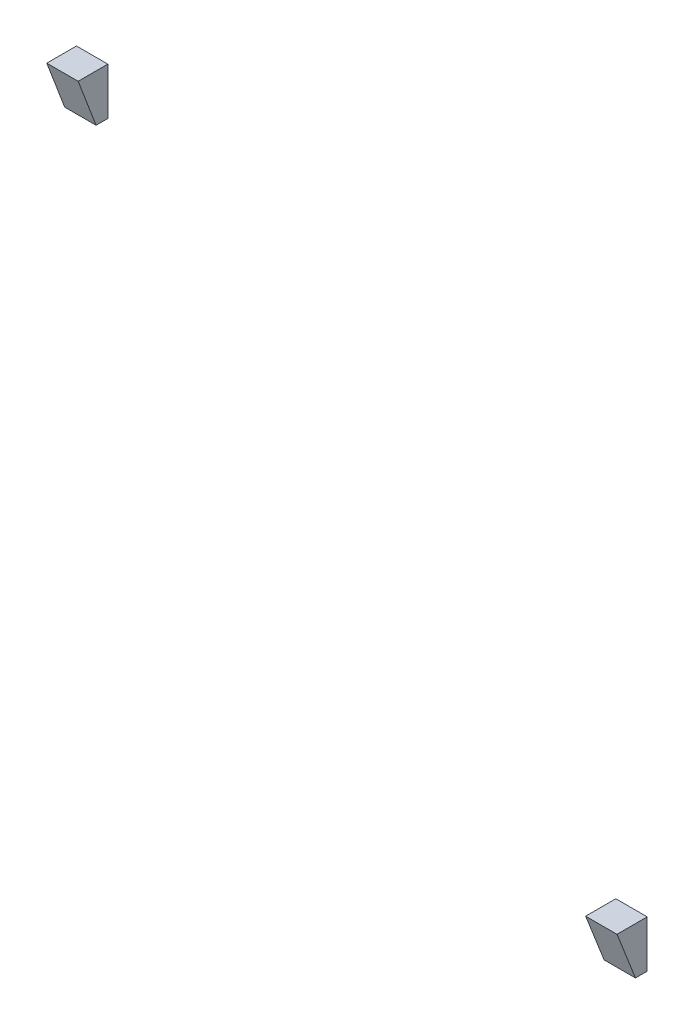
SolidWorks part; units mm, degrees
ref_plane "前视基准面" through (0, 0, 0) normal (0, 0, 1) x (1, 0, 0)
ref_plane "上视基准面" through (0, 0, 0) normal (0, 1, 0) x (1, 0, 0)
ref_plane "右视基准面" through (0, 0, 0) normal (1, 0, 0) x (0, 0, -1)
other "Configuration Table"
sketch "草图1" plane through (0, 0, 0) normal (0, 0, 1) x (1, 0, 0)
  line L9 (-36, 34.75) -> (-32, 34.75)
  line L10 (-36, 34.75) -> (-36, 28.75)
  line L11 (-36, 28.75) -> (-32, 28.75)
  line L12 (-32, 34.75) -> (-32, 28.75)
  line L13 (32.75, -25) -> (36.75, -25)
  line L14 (32.75, -25) -> (32.75, -31)
  line L15 (32.75, -31) -> (36.75, -31)
  line L16 (36.75, -25) -> (36.75, -31)
extrude "凸台-拉伸1" add sketch "草图1" along normal blind 5
sketch "草图2" plane through (-36, 0, 0) normal (-1, 0, 0) x (0, 0, 1)
  line L0 (1.5, 28.75) -> (3.7822, 34.75)
extrude "切除-拉伸1" cut sketch "草图2" against normal through all and the other way through all flip side to cut
sketch "草图4" plane through (36.75, 0, 0) normal (1, 0, 0) x (0, 0, -1)
  line L0 (-3.8496, -25) -> (-1.5, -31)
extrude "切除-拉伸2" cut sketch "草图4" against normal through all and the other way through all flip side to cut
